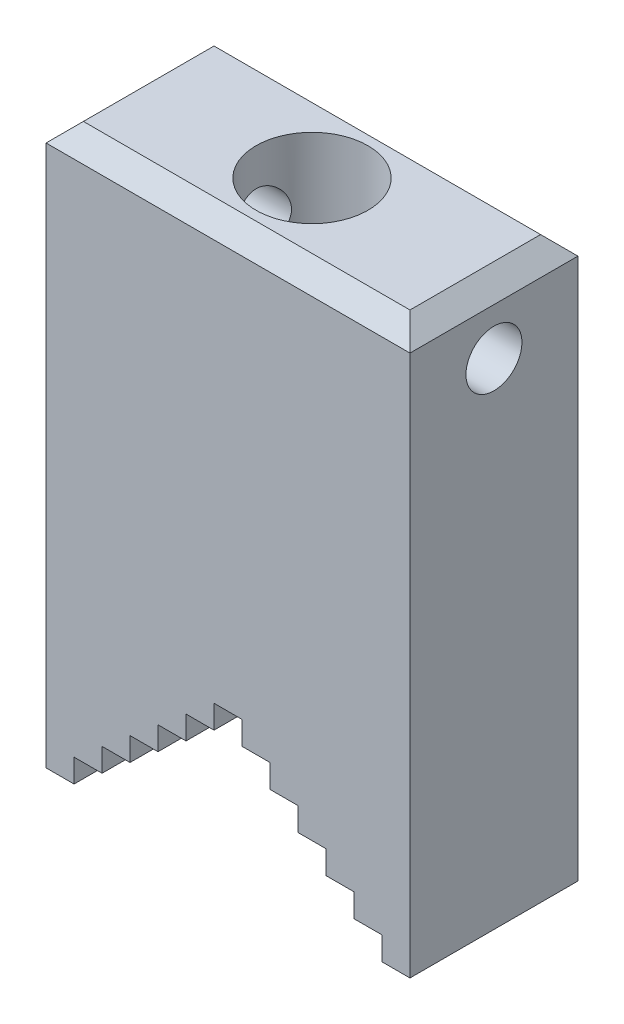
SolidWorks part; units mm, degrees
ref_plane "Front" through (0, 0, 0) normal (0, 0, 1) x (1, 0, 0)
ref_plane "Top" through (0, 0, 0) normal (0, 1, 0) x (1, 0, 0)
ref_plane "Right" through (0, 0, 0) normal (1, 0, 0) x (0, 0, -1)
sketch "Sketch1" plane through (0, 0, 0) normal (0, 0, 1) x (1, 0, 0)
  line L0 (19.5, -30) -> (-19.5, 30) construction
  line L1 (-19.5, 30) -> (19.5, 30)
  line L2 (-19.5, 30) -> (-19.5, -30)
  line L3 (-19.5, -30) -> (-16.5, -30)
  line L4 (19.5, 30) -> (19.5, -30)
  line L5 (0, 4.2016) -> (0, -34.1199) construction
  line L6 (-16.5, -30) -> (-16.5, -27.5)
  line L7 (-16.5, -27.5) -> (-13.5, -27.5)
  line L8 (-13.5, -27.5) -> (-13.5, -25)
  line L9 (-13.5, -25) -> (-10.5, -25)
  line L10 (-10.5, -25) -> (-10.5, -22.5)
  line L11 (-10.5, -22.5) -> (-7.5, -22.5)
  line L12 (-7.5, -22.5) -> (-7.5, -20)
  line L13 (-7.5, -20) -> (-4.5, -20)
  line L14 (-4.5, -20) -> (-4.5, -17.5)
  line L15 (-4.5, -17.5) -> (-1.5, -17.5)
  line L16 (-1.5, -17.5) -> (-1.5, -15)
  line L17 (-1.5, -15) -> (1.5, -15)
  line L18 (1.5, -17.5) -> (1.5, -15)
  line L19 (4.5, -17.5) -> (1.5, -17.5)
  line L20 (4.5, -20) -> (4.5, -17.5)
  line L21 (7.5, -20) -> (4.5, -20)
  line L22 (7.5, -22.5) -> (7.5, -20)
  line L23 (10.5, -22.5) -> (7.5, -22.5)
  line L24 (10.5, -25) -> (10.5, -22.5)
  line L25 (13.5, -25) -> (10.5, -25)
  line L26 (13.5, -27.5) -> (13.5, -25)
  line L27 (16.5, -27.5) -> (13.5, -27.5)
  line L28 (16.5, -30) -> (16.5, -27.5)
  line L29 (16.5, -30) -> (19.5, -30)
  point P20 (0, -15)
  dimension "D1" = 39
  dimension "D2" = 60
  dimension "D3" = 2.5
  dimension "D4" = 3
  dimension "D5" = 3
extrude "Extrude1" add sketch "Sketch1" along normal mid plane 18
sketch "Sketch2" plane through (19.5, 0, 0) normal (1, 0, 0) x (0, 0, -1)
  line L0 (9, -30) -> (9, 30) construction
  line L2 (-9, 30) -> (9, 30) construction
  point P0 (0, 23)
  dimension "D1" = 9
  dimension "D2" = 7
other "Hole1"
sketch "Sketch3" plane through (19.5, 0, 0) normal (1, 0, 0) x (0, 0, -1)
  circle A0 centre (0, 23) radius 3
  dimension "D1" = 6
sketch "Sketch4" plane through (0, 0, 0) normal (0, 0, 1) x (1, 0, 0)
  line L0 (0, 0) -> (0, 34.7467) construction
  line L1 (6, 30) -> (6, 10)
  line L2 (19.5, 30) -> (-19.5, 30) construction
  line L3 (6, 10) -> (0, 6.5359)
  line L4 (0, 6.5359) -> (0, 30)
  line L5 (0, 30) -> (6, 30)
  dimension "D1" = 12
  dimension "D2" = 60
  dimension "D4" = 20
revolve "Cut-Revolve1" cut sketch "Sketch4" angle 360 about L0
chamfer "Chamfer1" distance 2 angle 45 4 edges at (19.5, 30, 0) (0, 30, 9) (-19.5, 30, 0) (0, 30, -9)
